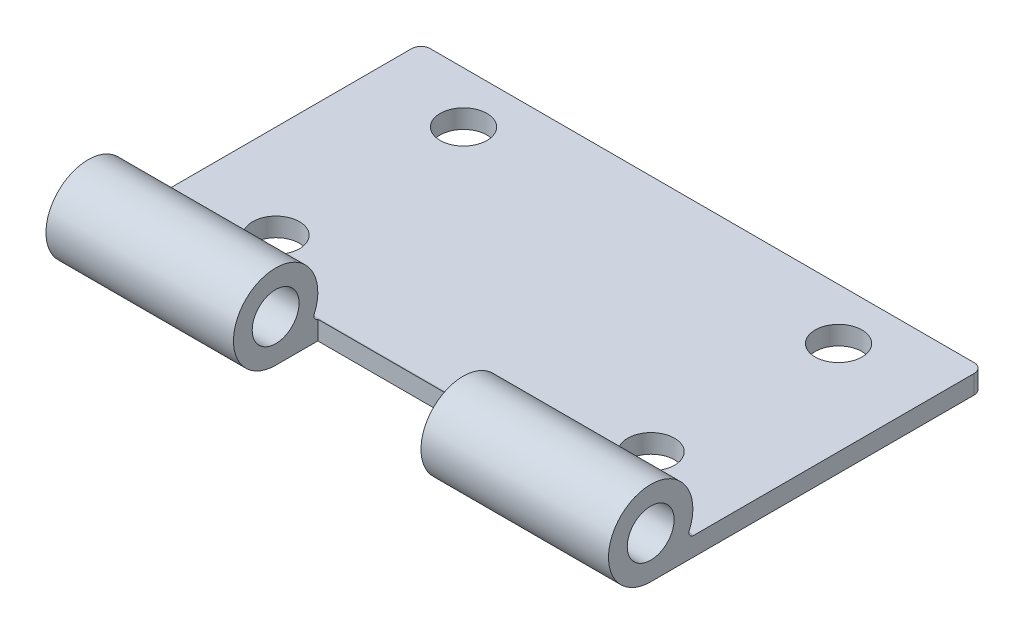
SolidWorks part; units mm, degrees
ref_plane "Front Plane" through (0, 0, 0) normal (0, 0, 1) x (1, 0, 0)
ref_plane "Top Plane" through (0, 0, 0) normal (0, 1, 0) x (1, 0, 0)
ref_plane "Right Plane" through (0, 0, 0) normal (1, 0, 0) x (0, 0, -1)
sketch "Sketch1" plane through (0, 0, 0) normal (1, 0, 0) x (0, 0, -1)
  line L0 (4.0488, 4.238) -> (-31.4512, 4.238)
  line L1 (4.0488, 6.238) -> (-26.8686, 6.238)
  line L2 (4.0488, 6.238) -> (-35.9512, 6.238) construction
  line L3 (4.0488, 4.238) -> (4.0488, 6.238)
  line L4 (4.0488, 4.238) -> (-35.9512, 4.238) construction
  circle A3 centre (-31.4512, 8.738) radius 2.5
  arc A4 (-27.3269, 6.938) -> (-31.4512, 4.238) centre (-31.4512, 8.738) ccw
  circle A5 centre (-31.4512, 8.738) radius 4.5 construction
  arc A6 (-26.8686, 6.238) -> (-27.3269, 6.938) centre (-26.8686, 6.738) cw
  dimension "D3" = 5
  dimension "D4" = 2
  dimension "D1" = 0.5
  dimension "D2" = 2
extrude "Boss-Extrude1" add sketch "Sketch1" along normal blind 60
sketch "Sketch2" plane through (0, 0, 0) normal (0, 1, 0) x (1, 0, 0)
  line L0 (60, -26.9512) -> (0, -26.9512) construction
  line L1 (20, -26.9512) -> (40, -26.9512)
  line L2 (20, -26.9512) -> (20, -35.9512)
  line L3 (20, -35.9512) -> (40, -35.9512)
  line L4 (40, -26.9512) -> (40, -35.9512)
  line L5 (0, -35.9512) -> (60, -35.9512) construction
  line L6 (0, -4.95) -> (0, 4.95) construction
  line L7 (60, -35.9512) -> (60, -26.9512) construction
  dimension "D1" = 20
  dimension "D2" = 20
extrude "Cut-Extrude1" cut sketch "Sketch2" along normal blind 60
sketch "Sketch3" plane through (0, 6.238, 0) normal (0, 1, 0) x (1, 0, 0)
  line L2 (10, -1.4099) -> (50, -1.4099) construction
  line L4 (10, -1.4099) -> (10, -21.4099) construction
  line L11 (10, -21.4099) -> (50, -21.4099) construction
  line L12 (50, -1.4099) -> (50, -21.4099) construction
  line L13 (30, -21.4099) -> (30, -1.4099) construction
  line L14 (10, -11.4099) -> (50, -11.4099) construction
  circle A0 centre (10, -1.4099) radius 2.5
  circle A1 centre (10, -21.4099) radius 2.5
  circle A2 centre (50, -21.4099) radius 2.5
  circle A3 centre (50, -1.4099) radius 2.5
  point P0 (30, -11.4099)
  point P10 (30, -11.4099)
  dimension "D1" = 5
  dimension "D3" = 20
  dimension "D4" = 40
extrude "Cut-Extrude2" cut sketch "Sketch3" against normal blind 60
fillet "Fillet1" radius 1 2 edges at (60, 5.238, -4.0488) (0, 5.238, -4.0488)
